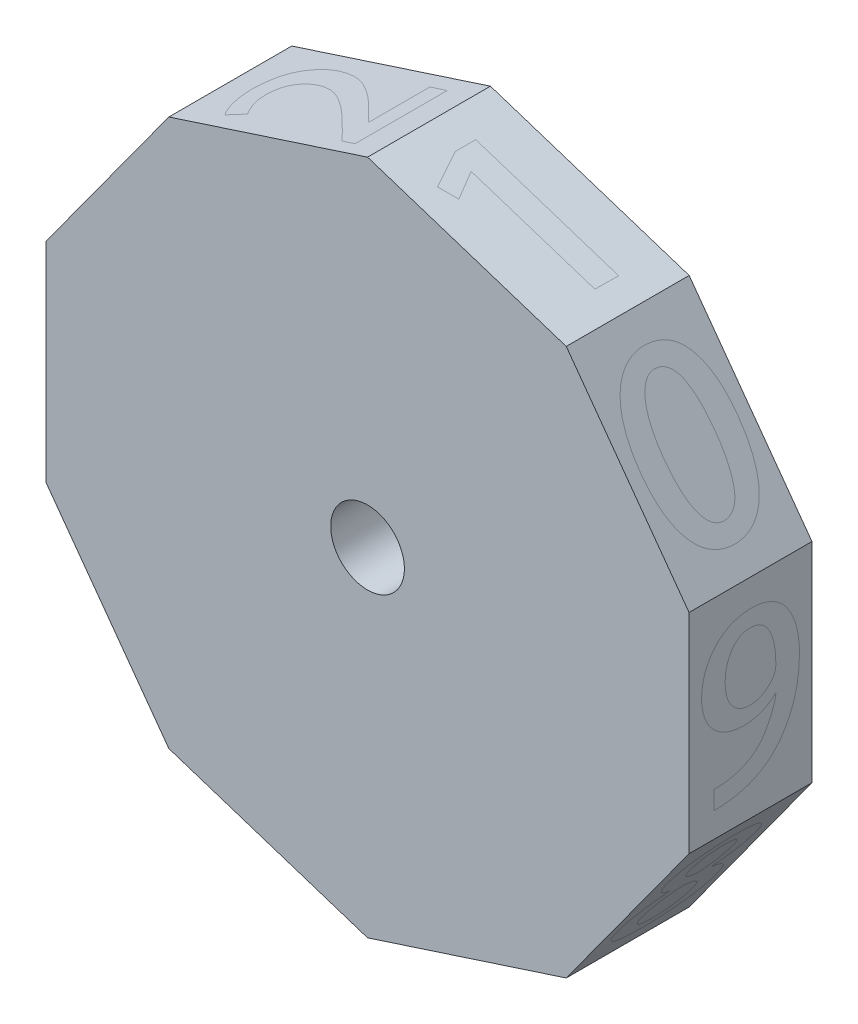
SolidWorks part; units mm, degrees
ref_plane "前基準面" through (0, 0, 0) normal (0, 0, 1) x (1, 0, 0)
ref_plane "上基準面" through (0, 0, 0) normal (0, 1, 0) x (1, 0, 0)
ref_plane "右基準面" through (0, 0, 0) normal (1, 0, 0) x (0, 0, -1)
sketch "草圖1" plane through (0, 0, 0) normal (0, 0, 1) x (1, 0, 0)
  line L0 (32.3359, -44.5066) -> (52.3206, -17)
  line L1 (0, 55.0132) -> (-32.3359, 44.5066)
  line L2 (-32.3359, 44.5066) -> (-52.3206, 17)
  line L3 (-52.3206, 17) -> (-52.3206, -17)
  line L4 (-52.3206, -17) -> (-32.3359, -44.5066)
  line L5 (-32.3359, -44.5066) -> (0, -55.0132)
  line L6 (0, -55.0132) -> (32.3359, -44.5066)
  line L7 (52.3206, -17) -> (52.3206, 17)
  line L8 (52.3206, 17) -> (32.3359, 44.5066)
  line L9 (32.3359, 44.5066) -> (0, 55.0132)
  circle A0 centre (0, 0) radius 52.3206 construction
  circle A1 centre (0, 0) radius 6
  dimension "D2" = 12
  dimension "D1" = 34
extrude "填料-伸長1" add sketch "草圖1" along normal mid plane 20
sketch "草圖2" plane through (42.3283, 30.7533, 0) normal (0.809, 0.5878, 0) x (0, 0, -1)
  line L0 (-10, -12.5) -> (10, -12.5) construction
  line L1 (-10, -17) -> (-10, 17) construction
  line L2 (10, -17) -> (10, 17) construction
  line L3 (-10, -17) -> (10, -17) construction
  text T0 "0" font "@Adobe 黑体 Std R" height 25
  dimension "D1" = 4.5
wrap "包覆1" sketch "草圖2" wrap type scribe source sketch "草圖2"
sketch "草圖3" plane through (16.168, 49.7599, 0) normal (0.309, 0.9511, 0) x (0.9511, -0.309, 0)
  line L0 (12.5, 10) -> (12.5, -10) construction
  line L1 (17, 10) -> (-17, 10) construction
  line L2 (17, -10) -> (-17, -10) construction
  line L3 (17, -10) -> (17, 10) construction
  text T0 "1" font "@Adobe 黑体 Std R" height 25
  dimension "D1" = 4.5
wrap "包覆2" sketch "草圖3" wrap type scribe source sketch "草圖3"
sketch "草圖4" plane through (-16.168, 49.7599, 0) normal (-0.309, 0.9511, 0) x (0.9511, 0.309, 0)
  line L0 (12.5, 10) -> (12.5, -10) construction
  line L1 (17, 10) -> (-17, 10) construction
  line L2 (17, -10) -> (-17, -10) construction
  line L3 (17, -10) -> (17, 10) construction
  text T0 "2" font "@Adobe 黑体 Std R" height 25
  dimension "D1" = 4.5
wrap "包覆3" sketch "草圖4" wrap type scribe source sketch "草圖4"
sketch "草圖5" plane through (-42.3283, 30.7533, 0) normal (-0.809, 0.5878, 0) x (0, 0, 1)
  line L0 (-10, 12.5) -> (10, 12.5) construction
  line L1 (-10, 17) -> (-10, -17) construction
  line L2 (10, 17) -> (10, -17) construction
  line L3 (10, 17) -> (-10, 17) construction
  text T0 "3" font "@Adobe 黑体 Std R" height 25
  dimension "D1" = 4.5
wrap "包覆4" sketch "草圖5" wrap type scribe source sketch "草圖5"
sketch "草圖6" plane through (-52.3206, 0, 0) normal (-1, 0, 0) x (0, 0, 1)
  line L0 (10, 12.5) -> (-10, 12.5) construction
  line L1 (10, 17) -> (10, -17) construction
  line L2 (-10, 17) -> (-10, -17) construction
  line L3 (10, 17) -> (-10, 17) construction
  text T0 "4" font "@Adobe 黑体 Std R" height 25
  dimension "D1" = 4.5
wrap "包覆5" sketch "草圖6" wrap type scribe source sketch "草圖6"
sketch "草圖7" plane through (-42.3283, -30.7533, 0) normal (-0.809, -0.5878, 0) x (0, 0, 1)
  line L0 (-10, 12.5) -> (10, 12.5) construction
  line L1 (-10, 17) -> (-10, -17) construction
  line L2 (10, 17) -> (10, -17) construction
  line L3 (10, 17) -> (-10, 17) construction
  text T0 "5" font "@Adobe 黑体 Std R" height 25
  dimension "D1" = 4.5
wrap "包覆6" sketch "草圖7" wrap type scribe source sketch "草圖7"
sketch "草圖8" plane through (-16.168, -49.7599, 0) normal (-0.309, -0.9511, 0) x (0.9511, -0.309, 0)
  line L0 (-12.5, 10) -> (-12.5, -10) construction
  line L1 (-17, 10) -> (17, 10) construction
  line L2 (-17, -10) -> (17, -10) construction
  line L3 (-17, 10) -> (-17, -10) construction
  text T0 "6" font "@Adobe 黑体 Std R" height 25
  dimension "D1" = 4.5
wrap "包覆7" sketch "草圖8" wrap type scribe source sketch "草圖8"
sketch "草圖9" plane through (16.168, -49.7599, 0) normal (0.309, -0.9511, 0) x (0.9511, 0.309, 0)
  line L0 (-12.5, 10) -> (-12.5, -10) construction
  line L1 (-17, 10) -> (17, 10) construction
  line L2 (-17, -10) -> (17, -10) construction
  line L3 (-17, 10) -> (-17, -10) construction
  text T0 "7" font "@Adobe 黑体 Std R" height 25
  dimension "D1" = 4.5
wrap "包覆8" sketch "草圖9" wrap type scribe source sketch "草圖9"
sketch "草圖10" plane through (42.3283, -30.7533, 0) normal (0.809, -0.5878, 0) x (0, 0, -1)
  line L0 (-10, -12.5) -> (10, -12.5) construction
  line L1 (-10, -17) -> (-10, 17) construction
  line L2 (10, -17) -> (10, 17) construction
  line L3 (-10, -17) -> (10, -17) construction
  text T0 "8" font "@Adobe 黑体 Std R" height 25
  dimension "D1" = 4.5
wrap "包覆9" sketch "草圖10" wrap type scribe source sketch "草圖10"
sketch "草圖11" plane through (52.3206, 0, 0) normal (1, 0, 0) x (0, 0, -1)
  line L0 (-10, -12.5) -> (10, -12.5) construction
  line L1 (-10, -17) -> (-10, 17) construction
  line L2 (10, -17) -> (10, 17) construction
  line L3 (-10, -17) -> (10, -17) construction
  text T0 "9" font "@Adobe 黑体 Std R" height 25
  dimension "D1" = 4.5
wrap "包覆10" sketch "草圖11" wrap type scribe source sketch "草圖11"
sketch "草圖12" plane through (0, 0, 0) normal (0, 0, 1) x (1, 0, 0)
  line L0 (0, 0) -> (16.168, -49.7599) construction
  line L1 (0, -55.0132) -> (32.3359, -44.5066) construction
  line L2 (8.084, -24.8799) -> (18.4152, -21.5231) construction
  line L3 (0, 0) -> (42.3283, 30.7533) construction
  line L4 (52.3206, 17) -> (32.3359, 44.5066) construction
  line L5 (21.1641, 15.3766) -> (30.8435, 2.0541) construction
ref_plane "7 plane" through (0, 0, 0) normal (0.9511, 0.309, 0) x (0, 0, -1)
ref_plane "0 plane" through (0, 0, 0) normal (0.5878, -0.809, 0) x (-0.809, -0.5878, 0)
